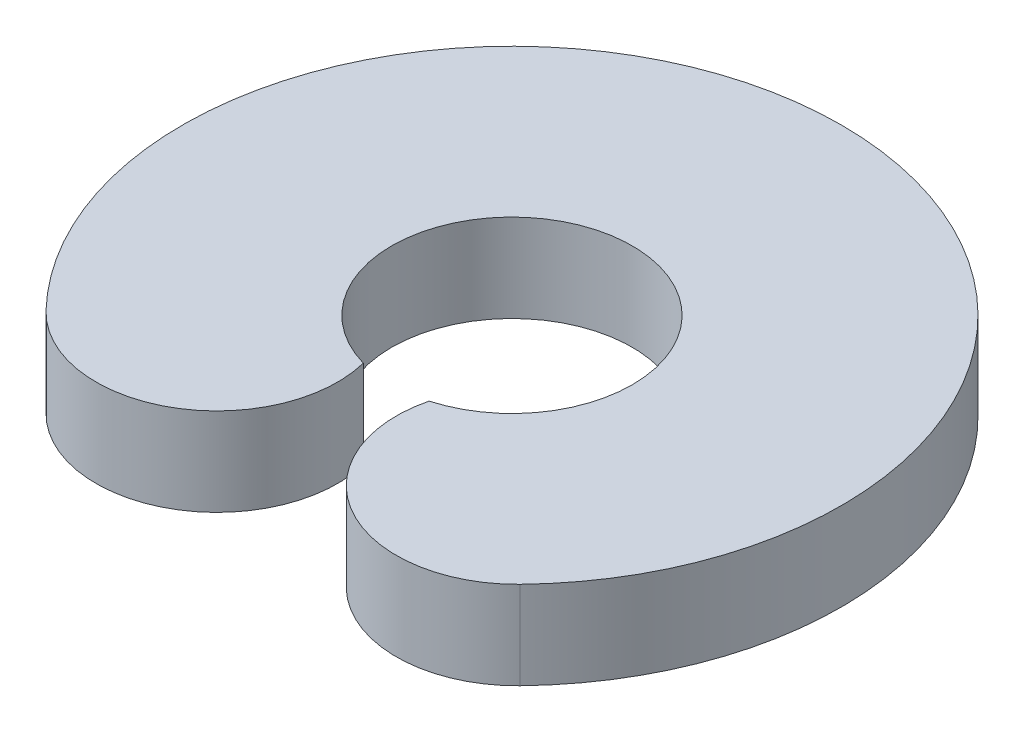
SolidWorks part; units mm, degrees
ref_plane "前视基准面" through (0, 0, 0) normal (0, 0, 1) x (1, 0, 0)
ref_plane "上视基准面" through (0, 0, 0) normal (0, 1, 0) x (1, 0, 0)
ref_plane "右视基准面" through (0, 0, 0) normal (1, 0, 0) x (0, 0, -1)
sketch "草图1" plane through (0, 0, 0) normal (0, 1, 0) x (1, 0, 0)
  line L0 (0, 0) -> (0, 475) construction
  line L1 (0, 0) -> (539.5049, -520.9938) construction
  line L2 (0, 0) -> (-539.5049, -520.9938) construction
  line L3 (0, 475) -> (-137.5, 236.843) construction
  line L4 (0, 475) -> (137.5, 236.843) construction
  line L5 (0, 0) -> (790.1582, 0) construction
  line L6 (0, 475) -> (0, 750) construction
  circle A0 centre (0, 0) radius 475 construction
  circle A1 centre (0, 475) radius 275 construction
  arc A2 (74.8551, -263.4342) -> (-74.8551, -263.4342) centre (0, 0) ccw
  arc A3 (539.5049, -520.9938) -> (-539.5049, -520.9938) centre (0, 0) ccw
  arc A4 (-539.5049, -520.9938) -> (-74.8551, -263.4342) centre (-341.6864, -329.9627) ccw
  arc A5 (74.8551, -263.4342) -> (539.5049, -520.9938) centre (341.6864, -329.9627) ccw
  dimension "D1" = 950
  dimension "D2" = 550
  dimension "D3" = 150
  dimension "D4" = 150
  dimension "D5" = 134
  dimension "D6" = 134
extrude "凸台-拉伸1" add sketch "草图1" along normal blind 200
